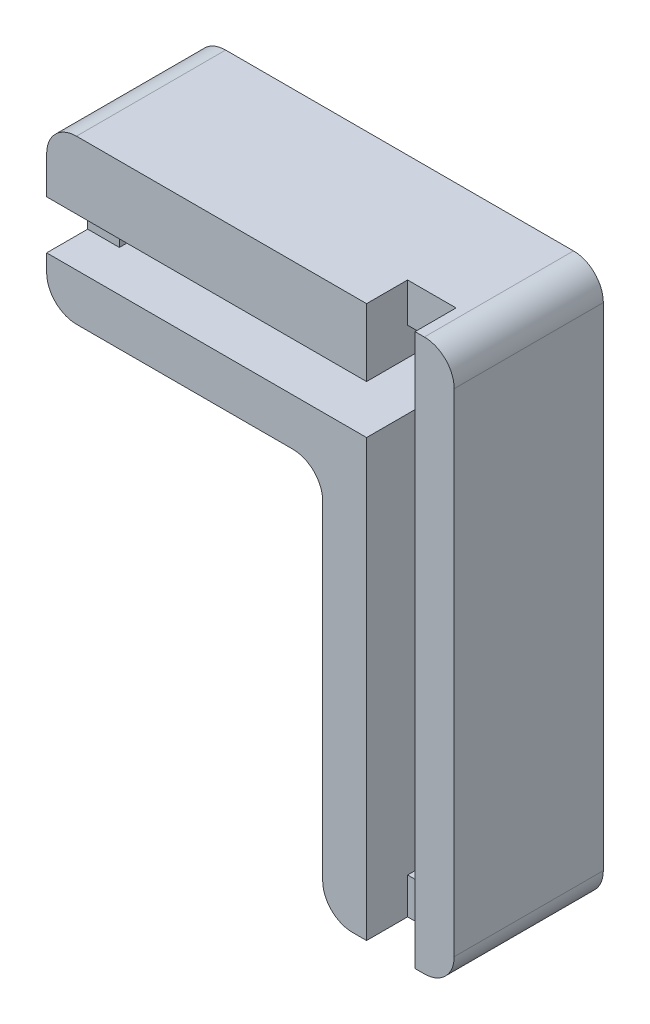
SolidWorks part; units mm, degrees
ref_plane "Front" through (0, 0, 0) normal (0, 0, 1) x (1, 0, 0)
ref_plane "Top" through (0, 0, 0) normal (0, 1, 0) x (1, 0, 0)
ref_plane "Right" through (0, 0, 0) normal (1, 0, 0) x (0, 0, -1)
sketch "Sketch1" plane through (0, 0, 0) normal (0, 0, 1) x (1, 0, 0)
  line L1 (0, 0) -> (54.65, 0)
  line L2 (0, 0) -> (0, 73.97)
  line L3 (0, 73.97) -> (54.65, 73.97)
  line L4 (54.65, 0) -> (54.65, 73.97)
  dimension "D1" = 73.97
  dimension "D2" = 54.65
extrude "Boss-Extrude1" add sketch "Sketch1" along normal blind 20
sketch "Sketch2" plane through (0, 0, 20) normal (0, 0, 1) x (1, 0, 0)
  line L0 (54.65, 0) -> (54.65, 73.97) construction
  line L1 (4.25, 64.92) -> (42.9, 64.92)
  line L2 (4.25, 64.92) -> (4.25, 58.42)
  line L3 (4.25, 58.42) -> (42.9, 58.42)
  line L4 (42.9, 64.92) -> (42.9, 58.42)
  line L5 (49.4, 68.72) -> (42.9, 68.72)
  line L6 (49.4, 68.72) -> (49.4, 4.87)
  line L7 (49.4, 4.87) -> (42.9, 4.87)
  line L8 (42.9, 68.72) -> (42.9, 4.87)
  line L10 (54.65, 73.97) -> (0, 73.97) construction
  line L12 (-51, 120.17) -> (-51, 3.17)
  line L13 (-51, 3.17) -> (98.15, 3.17)
  line L14 (98.15, 120.17) -> (98.15, 3.17)
  line L15 (-51, 120.17) -> (98.15, 120.17)
  line L16 (-12.35, 123.97) -> (-12.35, -50.38)
  line L17 (104.65, -50.38) -> (-12.35, -50.38)
  line L18 (104.65, 123.97) -> (104.65, -50.38)
  line L19 (104.65, 123.97) -> (-12.35, 123.97)
  line L20 (1.1703, 67.9997) -> (45.9797, 67.9997)
  line L21 (45.9797, 67.9997) -> (45.9797, 55.3403)
  line L22 (1.1703, 55.3403) -> (45.9797, 55.3403)
  line L23 (1.1703, 67.9997) -> (1.1703, 55.3403)
  line L24 (39.8203, 71.7997) -> (39.8203, 1.7903)
  line L25 (52.4797, 1.7903) -> (39.8203, 1.7903)
  line L26 (52.4797, 71.7997) -> (52.4797, 1.7903)
  line L27 (52.4797, 71.7997) -> (39.8203, 71.7997)
  dimension "D1" = 6.5
  dimension "D2" = 6.5
  dimension "D3" = 38.65
  dimension "D4" = 5.25
  dimension "D5" = 5.25
  dimension "D6" = 63.85
  dimension "D7" = 3.8
  dimension "D8" = 55.25
  dimension "D9" = 3.0797
extrude "Cut-Extrude1" cut sketch "Sketch2" against normal blind 15 contours L4 L1 L2 L3 | L5 L8 L4 L7 L6 | L14 L5 L8 L4 L13 | L1 L16 L3 L4
sketch "Sketch3" plane through (0, 0, 20) normal (0, 0, 1) x (1, 0, 0)
  line L1 (0, 0) -> (37.0146, 0)
  line L2 (0, 0) -> (0, 52.1212)
  line L3 (0, 52.1212) -> (37.0146, 52.1212)
  line L4 (37.0146, 0) -> (37.0146, 52.1212)
extrude "Cut-Extrude2" cut sketch "Sketch3" against normal blind 20
sketch "Sketch4" plane through (0, 0, 20) normal (0, 0, 1) x (1, 0, 0)
  line L0 (0, 73.97) -> (0, 52.1212) construction
  line L1 (4.25, 64.92) -> (0, 64.92)
  line L2 (4.25, 64.92) -> (4.25, 58.42)
  line L3 (4.25, 58.42) -> (0, 58.42)
  line L4 (0, 64.92) -> (0, 58.42)
  line L5 (54.65, 73.97) -> (0, 73.97) construction
  line L6 (42.9, 68.72) -> (49.4, 68.72)
  line L7 (42.9, 68.72) -> (42.9, 73.97)
  line L8 (42.9, 73.97) -> (49.4, 73.97)
  line L9 (49.4, 68.72) -> (49.4, 73.97)
  line L10 (37.0146, 0) -> (54.65, 0) construction
  line L11 (49.4, 4.87) -> (42.9, 4.87)
  line L12 (49.4, 4.87) -> (49.4, 0)
  line L13 (49.4, 0) -> (42.9, 0)
  line L14 (42.9, 4.87) -> (42.9, 0)
  dimension "D1" = 6.5
  dimension "D2" = 6.5
  dimension "D3" = 6.5
extrude "Cut-Extrude3" cut sketch "Sketch4" against normal blind 5.5
fillet "Fillet1" radius 4 6 edges at (54.65, 73.97, 10) (54.65, 0, 10) (37.0146, 0, 10) (37.0146, 52.1212, 10) (0, 52.1212, 10) (0, 73.97, 10)
